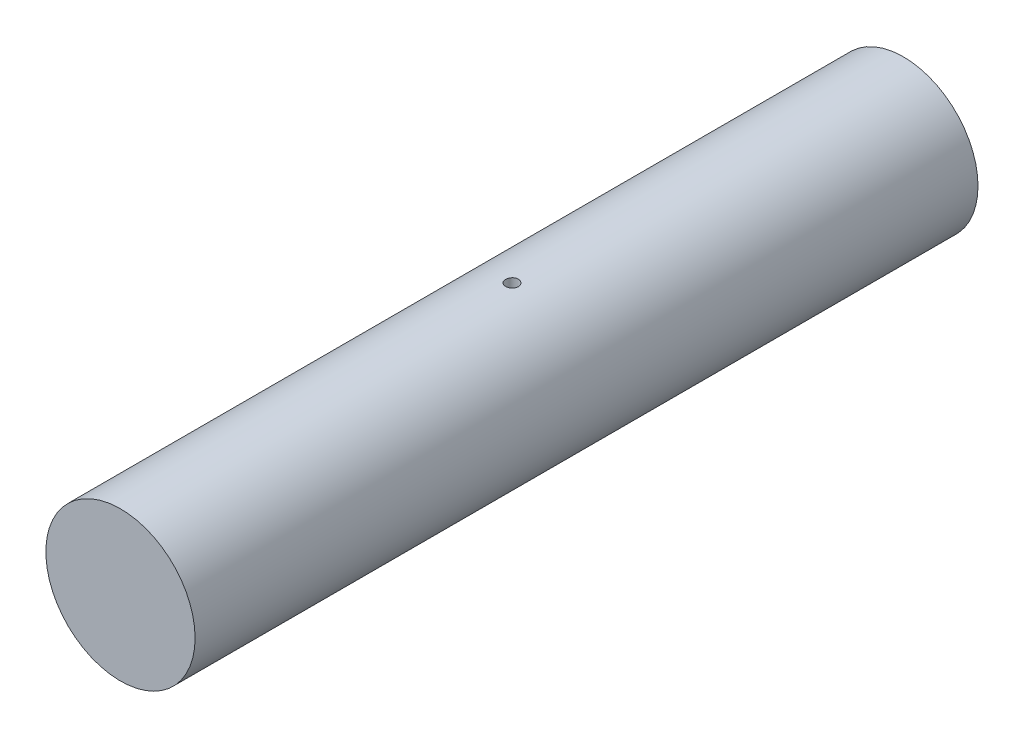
SolidWorks part; units mm, degrees
ref_plane "Front Plane" through (0, 0, 0) normal (0, 0, 1) x (1, 0, 0)
ref_plane "Top Plane" through (0, 0, 0) normal (0, 1, 0) x (1, 0, 0)
ref_plane "Right Plane" through (0, 0, 0) normal (1, 0, 0) x (0, 0, -1)
sketch "Sketch1" plane through (0, 0, 0) normal (0, 0, 1) x (1, 0, 0)
  circle A0 centre (0, 0) radius 77.47
  dimension "D1" = 154.94
extrude "Extrude1" add sketch "Sketch1" along normal mid plane 812.8
sketch "Sketch2" plane through (0, 0, 0) normal (0, 1, 0) x (1, 0, 0)
  circle A0 centre (0, 0) radius 6.604
extrude "Cut-Extrude1" cut sketch "Sketch2" against normal through all and the other way through all
